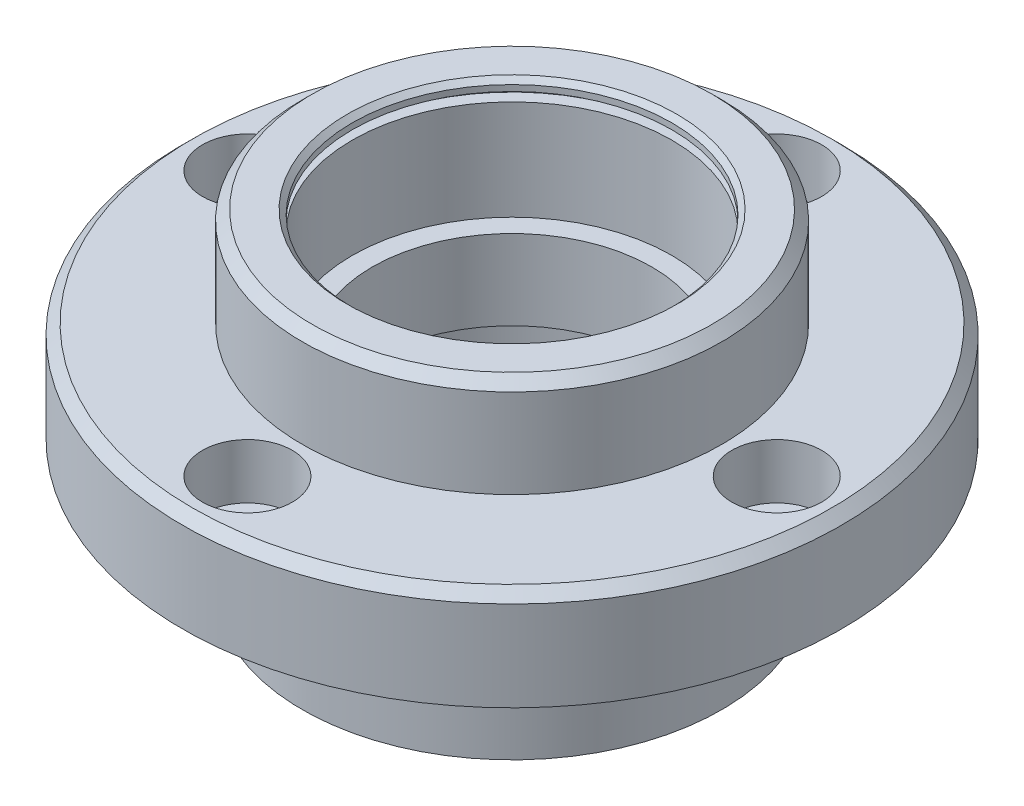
SolidWorks part; units mm, degrees
ref_plane "前视基准面" through (0, 0, 0) normal (0, 0, 1) x (1, 0, 0)
ref_plane "上视基准面" through (0, 0, 0) normal (0, 1, 0) x (1, 0, 0)
ref_plane "右视基准面" through (0, 0, 0) normal (1, 0, 0) x (0, 0, -1)
sketch "草图1" plane through (0, 0, 0) normal (0, 0, 1) x (1, 0, 0)
  line L0 (0, 0) -> (0, 91.4805) construction
  line L1 (-33, 23) -> (-33, 13)
  line L2 (-33, 13) -> (-21, 13)
  line L3 (-21, 13) -> (-21, 0)
  line L4 (-21, 0) -> (-16, 0)
  line L5 (-16, 0) -> (-16, 2)
  line L6 (-16, 2) -> (-17.2, 2)
  line L7 (-17.2, 2) -> (-17.2, 2.9)
  line L8 (-17.2, 2.9) -> (-16, 2.9)
  line L9 (-16, 2.9) -> (-16, 12.9)
  line L10 (-16, 12.9) -> (-14, 12.9)
  line L11 (-14, 12.9) -> (-14, 20.9)
  line L12 (-14, 20.9) -> (-16, 20.9)
  line L13 (-16, 20.9) -> (-16, 30.9)
  line L14 (-16, 30.9) -> (-17.2, 30.9)
  line L15 (-17.2, 30.9) -> (-17.2, 31.8)
  line L16 (-17.2, 31.8) -> (-16, 31.8)
  line L17 (-16, 31.8) -> (-16, 32.9)
  line L18 (-16, 32.9) -> (-21, 32.9)
  line L19 (-21, 32.9) -> (-21, 23)
  line L20 (-21, 23) -> (-33, 23)
  dimension "D1" = 2
  dimension "D2" = 0.9
  dimension "D3" = 0.9
  dimension "D4" = 1.2
  dimension "D5" = 5
  dimension "D6" = 12
  dimension "D7" = 2
  dimension "D8" = 32
  dimension "D9" = 10
  dimension "D10" = 8
  dimension "D11" = 10
  dimension "D12" = 1.1
  dimension "D13" = 13
  dimension "D14" = 10
revolve "旋转1" add sketch "草图1" angle 360 about L0
hole_wizard "M5 凹头盖螺钉的柱形沉头孔1" positions "草图3" profile "草图2" counterbore size "M5" standard "Ansi Metric"
sketch "草图3" plane through (0, 23, 0) normal (0, 1, 0) x (1, 0, 0)
  line L0 (0, 0) -> (-26.5, 0) construction
  point P0 (-26.5, 0)
  dimension "D1" = 26.5
sketch "草图2" plane through (-26.5, 23, 0) normal (1, 0, 0) x (0, 0, 1)
  line L0 (0, 0) -> (0, 23)
  line L1 (0, 23) -> (2.75, 23)
  line L3 (2.75, 23) -> (2.75, 5.5)
  line L4 (2.75, 5.5) -> (4.5, 5.5)
  line L5 (4.5, 5.5) -> (4.5, 0)
  line L7 (4.5, 0) -> (0, 0)
  line L11 (0, -6.35) -> (0, 107.95) construction
  dimension "通孔孔直径" = 5.5
  dimension "通孔孔深度" = 23
  dimension "柱形沉头孔直径" = 9
  dimension "柱形沉头孔深度" = 5.5
pattern_circular "阵列(圆周)1" count 4 over 360 about axis through (0, 0, 0) along (0, 1, 0) of "M5 凹头盖螺钉的柱形沉头孔1"
chamfer "倒角1" distance 1 angle 45 2 edges at (0, 32.9, -21) (0, 23, -33)
chamfer "倒角2" distance 0.5 angle 45 2 edges at (0, 0, -16) (0, 32.9, -16)
